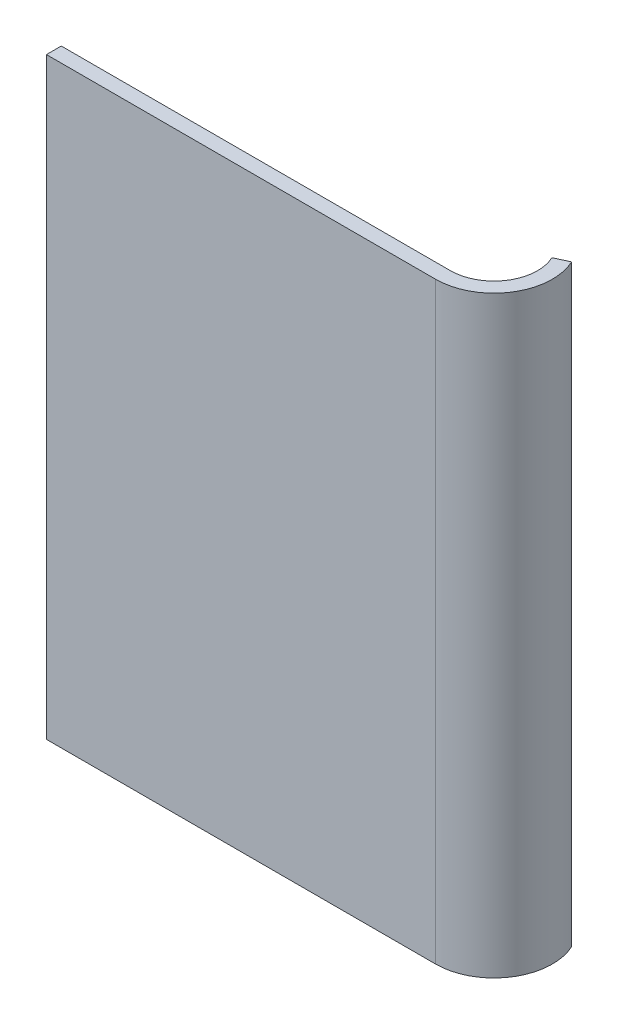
SolidWorks part; units mm, degrees
ref_plane "Front Plane" through (0, 0, 0) normal (0, 0, 1) x (1, 0, 0)
ref_plane "Top Plane" through (0, 0, 0) normal (0, 1, 0) x (1, 0, 0)
ref_plane "Right Plane" through (0, 0, 0) normal (1, 0, 0) x (0, 0, -1)
sketch "Sketch1" plane through (0, 0, 0) normal (0, 1, 0) x (1, 0, 0)
  line L0 (0, 0) -> (1000, 0)
  line L1 (0, 38.1) -> (1000, 38.1)
  line L2 (1101.4158, 197.291) -> (1135.9462, 213.3927)
  line L3 (0, 38.1) -> (0, 0)
  arc A0 (1000, 0) -> (1135.9462, 213.3927) centre (1000, 150) ccw
  arc A1 (1000, 38.1) -> (1101.4158, 197.291) centre (1000, 150) ccw
  dimension "D2" = 150
  dimension "D4" = 25
  dimension "D1" = 1000
  dimension "D3" = 38.1
extrude "Boss-Extrude1" add sketch "Sketch1" along normal blind 1524
